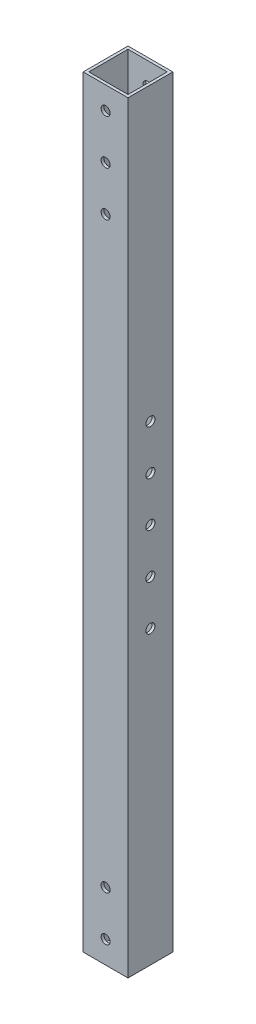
SolidWorks part; units mm, degrees
ref_plane "Front Plane" through (0, 0, 0) normal (0, 0, 1) x (1, 0, 0)
ref_plane "Top Plane" through (0, 0, 0) normal (0, 1, 0) x (1, 0, 0)
ref_plane "Right Plane" through (0, 0, 0) normal (1, 0, 0) x (0, 0, -1)
sketch "Sketch1" plane through (0, 0, 0) normal (0, 1, 0) x (1, 0, 0)
  line L1 (-12.7, -12.7) -> (12.7, -12.7)
  line L2 (-12.7, -12.7) -> (-12.7, 12.7)
  line L3 (-12.7, 12.7) -> (12.7, 12.7)
  line L4 (12.7, -12.7) -> (12.7, 12.7)
  line L5 (-12.7, -12.7) -> (12.7, 12.7) construction
  line L6 (-12.7, 12.7) -> (12.7, -12.7) construction
  line L7 (-11.1125, -11.1125) -> (11.1125, -11.1125)
  line L8 (-11.1125, -11.1125) -> (-11.1125, 11.1125)
  line L9 (-11.1125, 11.1125) -> (11.1125, 11.1125)
  line L10 (11.1125, -11.1125) -> (11.1125, 11.1125)
  line L11 (-11.1125, -11.1125) -> (11.1125, 11.1125) construction
  line L12 (-11.1125, 11.1125) -> (11.1125, -11.1125) construction
  point P0 (0, 0)
  point P6 (0, 0)
  dimension "D1" = 25.4
  dimension "D2" = 1.5875
extrude "Boss-Extrude1" add sketch "Sketch1" along normal blind 431.8
hole_wizard "#7 (0.201) Diameter Hole1" positions "Sketch2" profile "Sketch3" hole size "#7" standard "ANSI Inch"
sketch "Sketch2" plane through (0, 0, 12.7) normal (0, 0, 1) x (1, 0, 0)
  line L0 (-12.7, 0) -> (12.7, 0) construction
  point P0 (0, 12.7)
  point P12 (0, 38.1)
  point P25 (0, 368.3)
  point P26 (0, 393.7)
  point P27 (0, 419.1)
  point P30 (0, 342.9)
  point P31 (0, 317.5)
  point P32 (0, 292.1)
  point P33 (0, 266.7)
  point P34 (0, 241.3)
  point P35 (0, 215.9)
  point P36 (0, 190.5)
  point P37 (0, 165.1)
  point P38 (0, 139.7)
  point P39 (0, 114.3)
  point P40 (0, 88.9)
  point P41 (0, 63.5)
  dimension "D1" = 12.7
  dimension "D3" = 25.4
  dimension "D2" = 17
sketch "Sketch3" plane through (0, 12.7, 12.7) normal (1, 0, 0) x (0, -1, 0)
  line L0 (0, 0) -> (0, 25.4)
  line L1 (0, 25.4) -> (2.5527, 25.4)
  line L2 (2.5527, 25.4) -> (2.5527, 0)
  line L5 (2.5527, 0) -> (0, 0)
  line L11 (0, -6.35) -> (0, 107.95) construction
  dimension "Thru Hole Dia." = 5.1054
  dimension "Thru Hole Depth" = 25.4
hole_wizard "#7 (0.201) Diameter Hole2" positions "Sketch4" profile "Sketch5" hole size "#7" standard "ANSI Inch"
sketch "Sketch4" plane through (12.7, 0, 0) normal (1, 0, 0) x (0, 0, -1)
  line L1 (-12.7, 0) -> (12.7, 0) construction
  point P17 (0, 165.1)
  point P18 (0, 190.5)
  point P19 (0, 215.9)
  point P20 (0, 241.3)
  point P21 (0, 266.7)
  point P29 (0, 419.1)
  point P30 (0, 393.7)
  point P31 (0, 368.3)
  point P32 (0, 342.9)
  point P33 (0, 317.5)
  point P34 (0, 292.1)
  point P35 (0, 139.7)
  point P36 (0, 114.3)
  point P37 (0, 88.9)
  point P38 (0, 63.5)
  point P39 (0, 38.1)
  dimension "D1" = 165.1
  dimension "D3" = 25.4
  dimension "D2" = 25.4
  dimension "D4" = 25.4
  dimension "D5" = 25.4
sketch "Sketch5" plane through (12.7, 165.1, 0) normal (0, 1, 0) x (0, 0, -1)
  line L0 (0, 0) -> (0, 25.4)
  line L1 (0, 25.4) -> (2.5527, 25.4)
  line L2 (2.5527, 25.4) -> (2.5527, 0)
  line L5 (2.5527, 0) -> (0, 0)
  line L11 (0, -6.35) -> (0, 107.95) construction
  dimension "Thru Hole Dia." = 5.1054
  dimension "Thru Hole Depth" = 25.4
